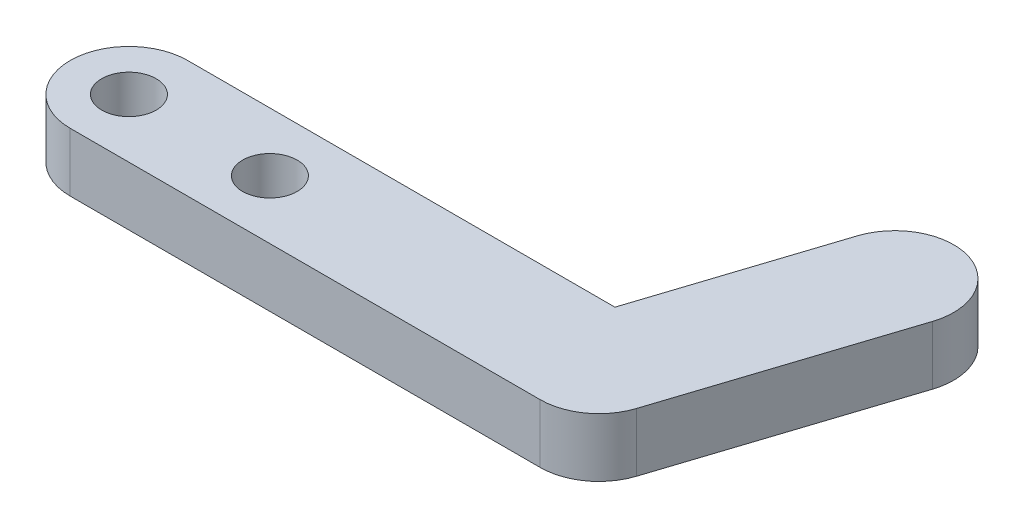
SolidWorks part; units mm, degrees
ref_plane "Front Plane" through (0, 0, 0) normal (0, 0, 1) x (1, 0, 0)
ref_plane "Top Plane" through (0, 0, 0) normal (0, 1, 0) x (1, 0, 0)
ref_plane "Right Plane" through (0, 0, 0) normal (1, 0, 0) x (0, 0, -1)
sketch "Sketch1" plane through (0, 0, 0) normal (0, 1, 0) x (1, 0, 0)
  line L0 (0, 0) -> (25.4, 0) construction
  line L1 (0, 3.175) -> (25.4, 3.175)
  line L2 (0, -3.175) -> (25.4, -3.175)
  line L3 (12.7, 3.175) -> (12.7, -3.175) construction
  arc A0 (0, 3.175) -> (0, -3.175) centre (0, 0) ccw
  arc A1 (25.4, -3.175) -> (25.4, 3.175) centre (25.4, 0) ccw
  point P3 (12.7, 0)
  dimension "D1" = 6.35
  dimension "D2" = 25.4
extrude "Boss-Extrude1" add sketch "Sketch1" along normal blind 3.175
sketch "Sketch2" plane through (0, 0, 0) normal (0, 1, 0) x (1, 0, 0)
  line L0 (25.4, 0) -> (29.3245, 12.0784) construction
  line L1 (22.3804, 0.9811) -> (26.3049, 13.0595)
  line L2 (28.4196, -0.9811) -> (32.3441, 11.0973)
  line L3 (24.3427, 7.0203) -> (30.3819, 5.0581) construction
  line L4 (12.7, 3.175) -> (12.7, -3.175) construction
  line L5 (0, 0) -> (25.4, 0) construction
  arc A0 (22.3804, 0.9811) -> (28.4196, -0.9811) centre (25.4, 0) ccw
  arc A1 (32.3441, 11.0973) -> (26.3049, 13.0595) centre (29.3245, 12.0784) ccw
  point P3 (27.3623, 6.0392)
  dimension "D1" = 108
  dimension "D2" = 12.7
extrude "Boss-Extrude2" add sketch "Sketch2" along normal blind 3.175
hole_wizard "#4 Clearance Hole1" positions "Sketch4" profile "Sketch3" hole size "#4" standard "ANSI Inch"
sketch "Sketch4" plane through (0, 3.175, 0) normal (0, 1, 0) x (1, 0, 0)
  point P0 (0, 0)
  point P3 (7.62, 0)
  dimension "D1" = 7.62
sketch "Sketch3" plane through (0, 3.175, 0) normal (1, 0, 0) x (0, 0, 1)
  line L0 (0, 0) -> (0, 3.175)
  line L1 (0, 3.175) -> (1.4732, 3.175)
  line L2 (1.4732, 3.175) -> (1.4732, 0)
  line L5 (1.4732, 0) -> (0, 0)
  line L11 (0, -6.35) -> (0, 107.95) construction
  dimension "Thru Hole Dia." = 2.9464
  dimension "Thru Hole Depth" = 3.175
